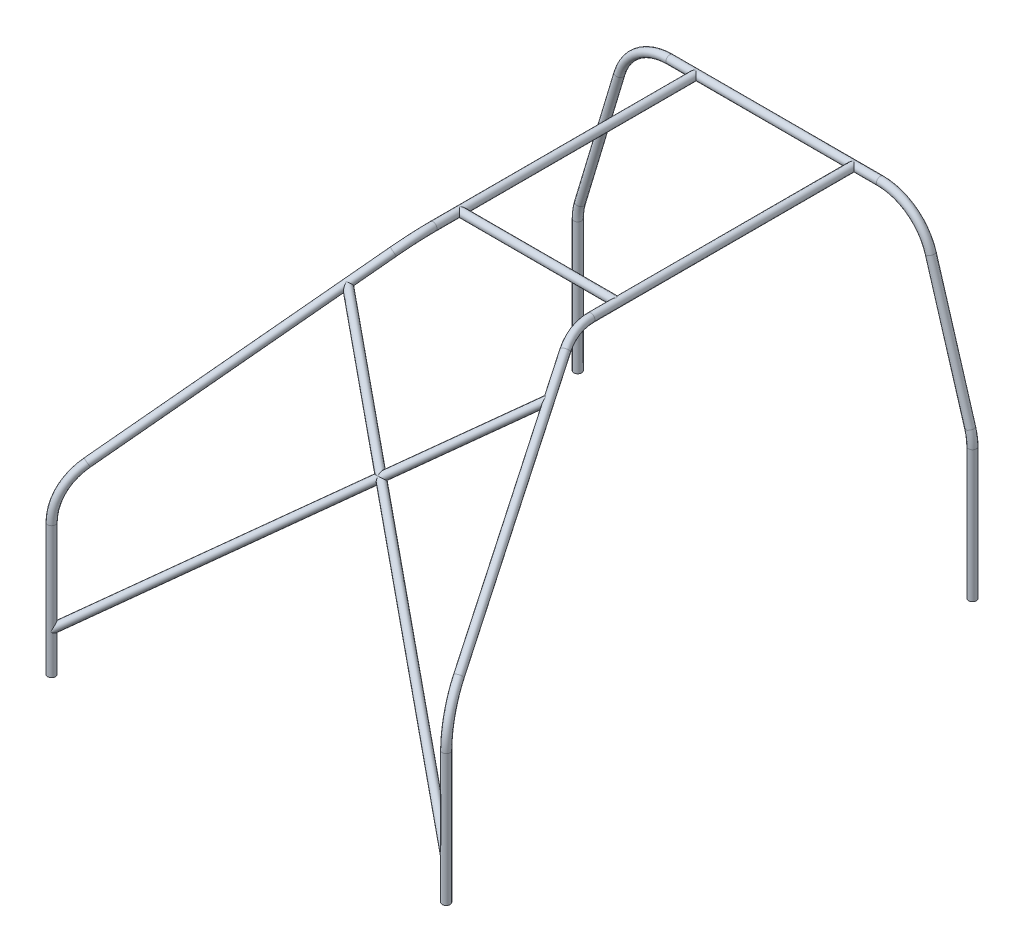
SolidWorks part; units mm, degrees
ref_plane "Płaszczyzna przednia" through (0, 0, 0) normal (0, 0, 1) x (1, 0, 0)
ref_plane "Płaszczyzna górna" through (0, 0, 0) normal (0, 1, 0) x (1, 0, 0)
ref_plane "Płaszczyzna prawa" through (0, 0, 0) normal (1, 0, 0) x (0, 0, -1)
sketch3d "Szkic 3D1"
  line L0 (-750, 0, 0) -> (-750, 500, 0)
  line L1 (-741.5653, 557.4696, 0) -> (-591.5653, 1057.4696, 0)
  line L2 (-400, 1200, 0) -> (400, 1200, 0)
  line L3 (591.5653, 1057.4696, 0) -> (741.5653, 557.4696, 0)
  line L4 (750, 500, 0) -> (750, 0, 0)
  line L5 (0, 0, 0) -> (0, 1200, 0) construction
  line L6 (-300, 1200, 0) -> (-300, 1200, 1000)
  line L7 (-326.3877, 1165.8007, 1124.1472) -> (-705.715, 674.1811, 1908.4371)
  line L8 (-750, 500, 2000) -> (-750, 0, 2000)
  line L9 (300, 1200, 0) -> (300, 1200, 1000)
  line L10 (326.3877, 1165.8007, 1124.1472) -> (705.715, 674.1811, 1908.4371)
  line L11 (750, 500, 2000) -> (750, 0, 2000)
  line L12 (-300, 1200, 900) -> (300, 1200, 900)
  line L13 (383.2672, 1092.0832, 1241.7502) -> (-750, 150, 2000)
  line L14 (-383.2672, 1092.0832, 1241.7502) -> (750, 150, 2000)
  arc A0 (741.5653, 557.4696, 0) -> (750, 500, 0) centre (550, 500, 0) ccw
  arc A1 (400, 1200, 0) -> (591.5653, 1057.4696, 0) centre (400, 1000, 0) ccw
  arc A2 (-591.5653, 1057.4696, 0) -> (-400, 1200, 0) centre (-400, 1000, 0) ccw
  arc A3 (-750, 500, 0) -> (-741.5653, 557.4696, 0) centre (-550, 500, 0) ccw
  arc A4 (-705.715, 674.1811, 1908.4371) -> (-750, 500, 2000) centre (-662.919, 500, 1819.953) ccw
  arc A5 (-300, 1200, 1000) -> (-326.3877, 1165.8007, 1124.1472) centre (-422.1764, 1041.6557, 1000) ccw
  arc A6 (705.715, 674.1811, 1908.4371) -> (750, 500, 2000) centre (662.919, 500, 1819.953) ccw
  arc A7 (326.3877, 1165.8007, 1124.1472) -> (300, 1200, 1000) centre (422.1764, 1041.6557, 1000) ccw
  point P13 (750, 529.3538, 0)
  point P14 (550, 500, -200)
  point P17 (548.8061, 1200, 0)
  point P18 (400, 1000, -200)
  point P21 (-548.8061, 1200, 0)
  point P22 (-400, 1000, -200)
  point P25 (-750, 529.3538, 0)
  point P26 (-550, 500, -200)
  point P32 (-750, 616.7864, 2000)
  point P33 (-482.8721, 500, 1907.034)
  point P36 (-300, 1200, 1069.5885)
  point P37 (-263.8321, 919.4793, 1000)
  point P44 (750, 616.7864, 2000)
  point P45 (842.966, 500, 1732.8721)
  point P48 (300, 1200, 1069.5885)
  point P49 (263.8321, 919.4793, 1000)
  point P55 (0, 0, 0)
  point P56 (0, 0, 0)
  dimension "D5" = 200
  dimension "D7" = 200
  dimension "D11" = 200
  dimension "D1" = 800
  dimension "D6" = 300
  dimension "D2" = 1500
  dimension "D3" = 500
  dimension "D4" = 1200
  dimension "D8" = 2000
  dimension "D9" = 1000
  dimension "D10" = 500
  dimension "D12" = 900
  dimension "D13" = 150
  dimension "D14" = 150
other "Rury 30 X 3(1)"
ref_plane "Płaszczyzna1" through (-750, 0, 0) normal (0, 1, 0) x (1, 0, 0)
sketch "Szkic1" plane through (-750, 0, 0) normal (0, 1, 0) x (1, 0, 0)
  circle A0 centre (0, 0) radius 15
  circle A1 centre (0, 0) radius 12
  point P5 (0, 15)
  point P6 (-15, 0)
  point P7 (0, -15)
  point P8 (15, 0)
  point P9 (0, 0)
  dimension "D1" = 30
  dimension "D2" = 3
